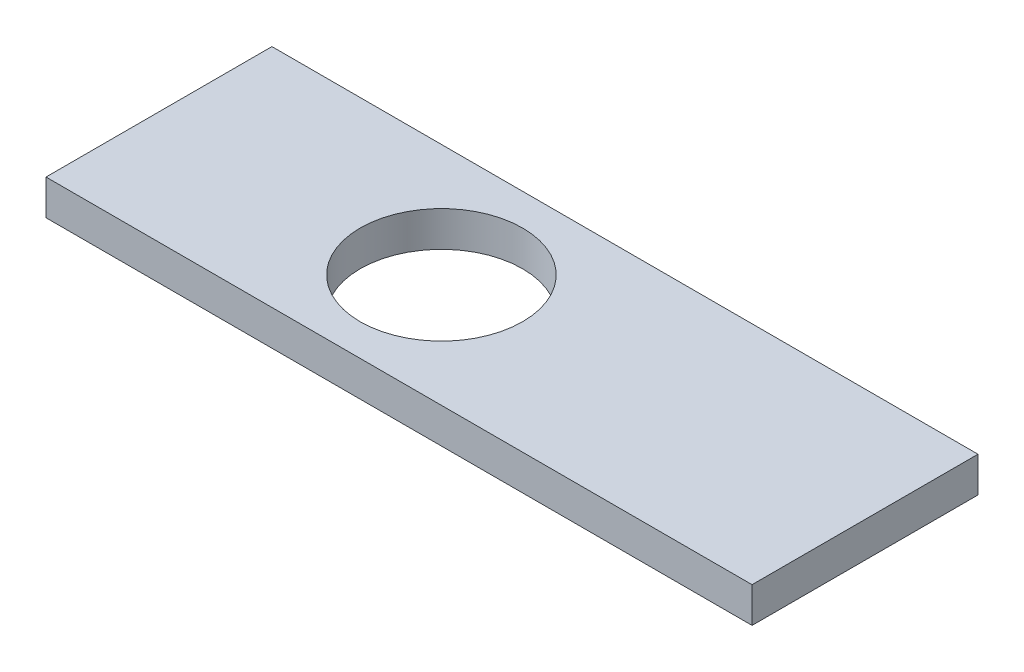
SolidWorks part; units mm, degrees
ref_plane "Front Plane" through (0, 0, 0) normal (0, 0, 1) x (1, 0, 0)
ref_plane "Top Plane" through (0, 0, 0) normal (0, 1, 0) x (1, 0, 0)
ref_plane "Right Plane" through (0, 0, 0) normal (1, 0, 0) x (0, 0, -1)
sketch "Sketch1" plane through (0, 0, 0) normal (0, 1, 0) x (1, 0, 0)
  line L1 (-50.8, -20.32) -> (76.2, -20.32)
  line L2 (-50.8, -20.32) -> (-50.8, 20.32)
  line L3 (-50.8, 20.32) -> (76.2, 20.32)
  line L4 (76.2, -20.32) -> (76.2, 20.32)
  dimension "D1" = 40.64
  dimension "D2" = 20.32
  dimension "D3" = 76.2
  dimension "D4" = 50.8
extrude "Boss-Extrude1" add sketch "Sketch1" against normal blind 6.35
sketch "Sketch2" plane through (0, 0, 0) normal (0, 1, 0) x (1, 0, 0)
  circle A0 centre (0, 0) radius 14.605
  dimension "D1" = 29.21
extrude "Cut-Extrude1" cut sketch "Sketch2" against normal through all
